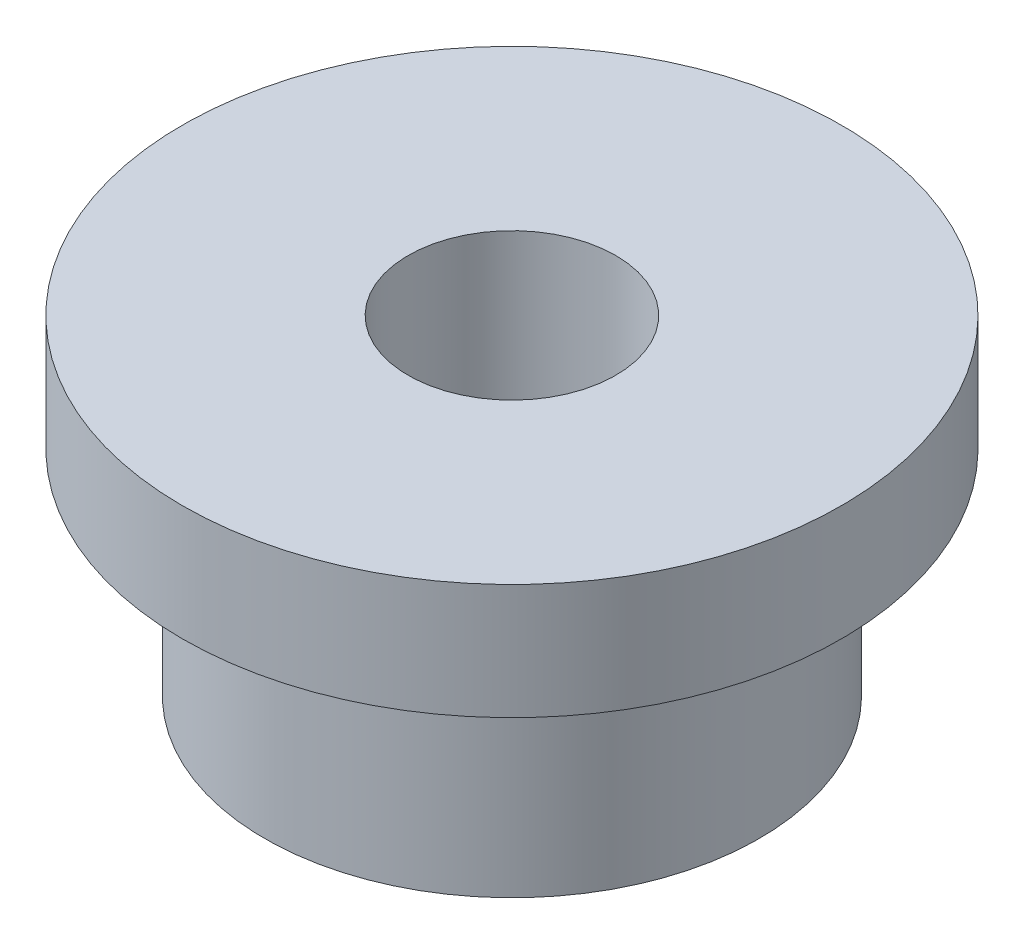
SolidWorks part; units mm, degrees
ref_plane "Front Plane" through (0, 0, 0) normal (0, 0, 1) x (1, 0, 0)
ref_plane "Top Plane" through (0, 0, 0) normal (0, 1, 0) x (1, 0, 0)
ref_plane "Right Plane" through (0, 0, 0) normal (1, 0, 0) x (0, 0, -1)
sketch "Sketch1" plane through (0, 0, 0) normal (0, 1, 0) x (1, 0, 0)
  circle A0 centre (0, 0) radius 3.15
  circle A1 centre (0, 0) radius 7.5
  dimension "D1" = 6.3
  dimension "D2" = 15
extrude "Boss-Extrude1" add sketch "Sketch1" along normal blind 6.5
sketch "Sketch2" plane through (0, 6.5, 0) normal (0, 1, 0) x (1, 0, 0)
  circle A0 centre (0, 0) radius 10
  circle A3 centre (0, 0) radius 3.15 construction
  circle A4 centre (0, 0) radius 3.15
  dimension "D2" = 20
extrude "Boss-Extrude2" add sketch "Sketch2" along normal blind 3.5
